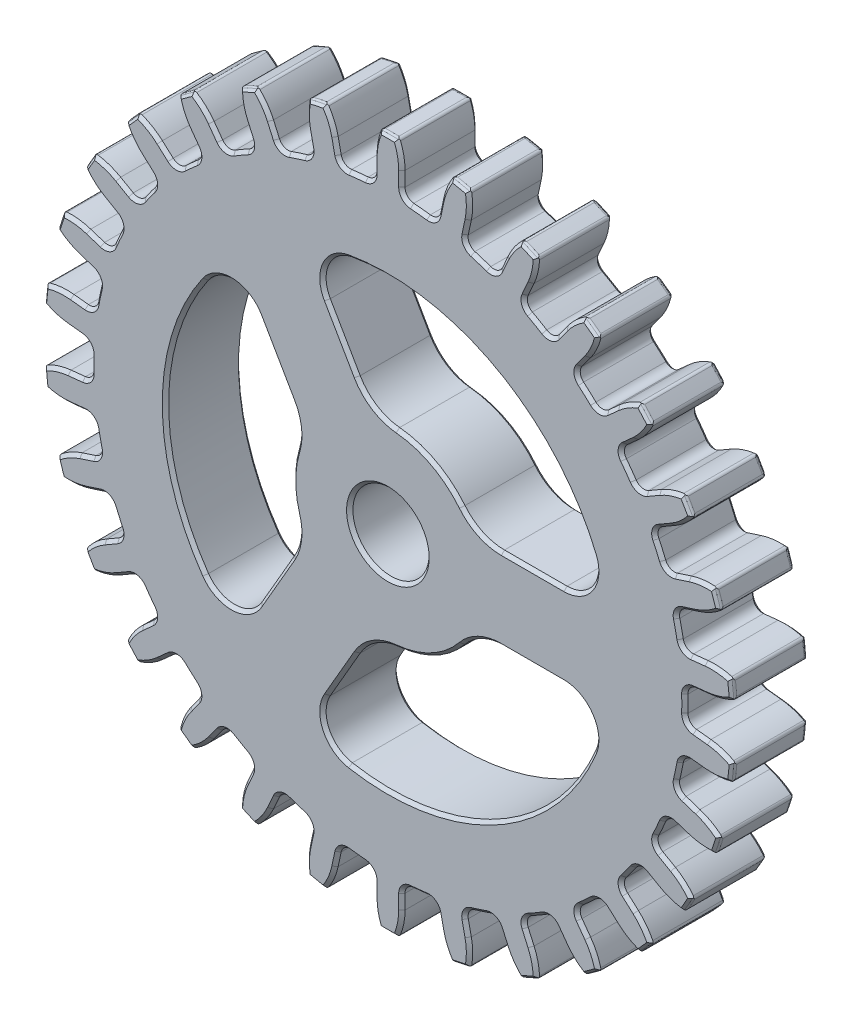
SolidWorks part; units mm, degrees
ref_plane "Спереди" through (0, 0, 0) normal (0, 0, 1) x (1, 0, 0)
ref_plane "Сверху" through (0, 0, 0) normal (0, 1, 0) x (1, 0, 0)
ref_plane "Справа" through (0, 0, 0) normal (1, 0, 0) x (0, 0, -1)
sketch "Эскиз1" plane through (0, 0, 0) normal (0, 0, 1) x (1, 0, 0)
  line L0 (0, 0) -> (27.2, 0) construction
  line L1 (0, 0) -> (0, 27.2) construction
  line L2 (8.9268, 3.25) -> (13.8542, 3.25)
  line L3 (8.9268, -3.25) -> (13.8542, -3.25)
  line L4 (-2.4255, -9.453) -> (-4.7744, -13.5213)
  line L5 (-7.5458, -5.3215) -> (-10.1442, -9.8222)
  line L6 (-7.5458, 5.3215) -> (-10.1442, 9.8222)
  line L7 (-2.4255, 9.453) -> (-4.7744, 13.5213)
  line L8 (0, 0) -> (-13.6, 23.5559) construction
  line L9 (-1.1, 25.2) -> (-1.1, 24.054)
  line L10 (1.1, 25.2) -> (1.1, 24.054)
  line L11 (4.1634, 24.878) -> (3.9251, 23.757)
  line L12 (6.3153, 24.4206) -> (6.0771, 23.2996)
  line L13 (9.2449, 23.4688) -> (8.7787, 22.4218)
  line L14 (11.2547, 22.5739) -> (10.7885, 21.527)
  line L15 (13.9223, 21.0338) -> (13.2486, 20.1066)
  line L16 (15.7021, 19.7407) -> (15.0285, 18.8135)
  line L17 (17.9912, 17.6796) -> (17.1395, 16.9127)
  line L18 (19.4633, 16.0446) -> (18.6116, 15.2778)
  line L19 (21.2738, 13.5526) -> (20.2813, 12.9796)
  line L20 (22.3738, 11.6474) -> (21.3813, 11.0744)
  line L21 (23.6267, 8.8334) -> (22.5368, 8.4792)
  line L22 (24.3065, 6.7411) -> (23.2166, 6.3869)
  line L23 (24.947, 3.7281) -> (23.8072, 3.6083)
  line L24 (25.1769, 1.5401) -> (24.0372, 1.4203)
  line L25 (25.1769, -1.5401) -> (24.0372, -1.4203)
  line L26 (24.947, -3.7281) -> (23.8072, -3.6083)
  line L27 (24.3065, -6.7411) -> (23.2166, -6.3869)
  line L28 (23.6267, -8.8334) -> (22.5368, -8.4792)
  line L29 (22.3738, -11.6474) -> (21.3813, -11.0744)
  line L30 (21.2738, -13.5526) -> (20.2813, -12.9796)
  line L31 (19.4633, -16.0446) -> (18.6116, -15.2778)
  line L32 (17.9912, -17.6796) -> (17.1395, -16.9127)
  line L33 (15.7021, -19.7407) -> (15.0285, -18.8135)
  line L34 (13.9223, -21.0338) -> (13.2486, -20.1066)
  line L35 (11.2547, -22.5739) -> (10.7885, -21.527)
  line L36 (9.2449, -23.4688) -> (8.7787, -22.4218)
  line L37 (6.3153, -24.4206) -> (6.0771, -23.2996)
  line L38 (4.1634, -24.878) -> (3.9251, -23.757)
  line L39 (1.1, -25.2) -> (1.1, -24.054)
  line L40 (-1.1, -25.2) -> (-1.1, -24.054)
  line L41 (-4.1634, -24.878) -> (-3.9251, -23.757)
  line L42 (-6.3153, -24.4206) -> (-6.0771, -23.2996)
  line L43 (-9.2449, -23.4688) -> (-8.7787, -22.4218)
  line L44 (-11.2547, -22.5739) -> (-10.7885, -21.527)
  line L45 (-13.9223, -21.0338) -> (-13.2486, -20.1066)
  line L46 (-15.7021, -19.7407) -> (-15.0285, -18.8135)
  line L47 (-17.9912, -17.6796) -> (-17.1395, -16.9127)
  line L48 (-19.4633, -16.0446) -> (-18.6116, -15.2778)
  line L49 (-21.2738, -13.5526) -> (-20.2813, -12.9796)
  line L50 (-22.3738, -11.6474) -> (-21.3813, -11.0744)
  line L51 (-23.6267, -8.8334) -> (-22.5368, -8.4792)
  line L52 (-24.3065, -6.7411) -> (-23.2166, -6.3869)
  line L53 (-24.947, -3.7281) -> (-23.8072, -3.6083)
  line L54 (-25.1769, -1.5401) -> (-24.0372, -1.4203)
  line L55 (-25.1769, 1.5401) -> (-24.0372, 1.4203)
  line L56 (-24.947, 3.7281) -> (-23.8072, 3.6083)
  line L57 (-24.3065, 6.7411) -> (-23.2166, 6.3869)
  line L58 (-23.6267, 8.8334) -> (-22.5368, 8.4792)
  line L59 (-22.3738, 11.6474) -> (-21.3813, 11.0744)
  line L60 (-21.2738, 13.5526) -> (-20.2813, 12.9796)
  line L61 (-19.4633, 16.0446) -> (-18.6116, 15.2778)
  line L62 (-17.9912, 17.6796) -> (-17.1395, 16.9127)
  line L63 (-15.7021, 19.7407) -> (-15.0285, 18.8135)
  line L64 (-13.9223, 21.0338) -> (-13.2486, 20.1066)
  line L65 (-11.2547, 22.5739) -> (-10.7885, 21.527)
  line L66 (-9.2449, 23.4688) -> (-8.7787, 22.4218)
  line L67 (-6.3153, 24.4206) -> (-6.0771, 23.2996)
  line L68 (-4.1634, 24.878) -> (-3.9251, 23.757)
  arc A0 (-13.6, 23.5559) -> (27.1141, -2.1597) centre (0, 0) ccw
  circle A1 centre (0, 0) radius 25.5 construction
  arc A2 (-1.7925, 23.3062) -> (-3.0923, 23.1696) centre (0, 0) ccw
  circle A3 centre (0, 0) radius 3
  arc A4 (5.8218, 4.7283) -> (0.6773, 7.4694) centre (0, 0) ccw
  arc A5 (16.1632, 6.7083) -> (-3.0442, 17.2332) centre (0, 0) ccw
  arc A6 (-14.3608, 10.0008) -> (-14.3608, -10.0008) centre (0, 0) ccw
  arc A7 (-3.0442, -17.2332) -> (16.1632, -6.7083) centre (0, 0) ccw
  arc A8 (0.6773, -7.4694) -> (5.8218, -4.7283) centre (0, 0) ccw
  arc A9 (-7.1804, 2.1662) -> (-7.1804, -2.1662) centre (0, 0) ccw
  arc A10 (-7.5458, 5.3215) -> (-7.1804, 2.1662) centre (-11.0099, 3.3215) cw
  arc A11 (-7.5458, -5.3215) -> (-7.1804, -2.1662) centre (-11.0099, -3.3215) ccw
  arc A12 (-2.4255, -9.453) -> (0.6773, -7.4694) centre (1.0386, -11.453) cw
  arc A13 (8.9268, -3.25) -> (5.8218, -4.7283) centre (8.9268, -7.25) ccw
  arc A14 (8.9268, 3.25) -> (5.8218, 4.7283) centre (8.9268, 7.25) cw
  arc A15 (-2.4255, 9.453) -> (0.6773, 7.4694) centre (1.0386, 11.453) ccw
  arc A16 (-10.1442, -9.8222) -> (-14.3608, -10.0008) centre (-12.3093, -8.5722) cw
  arc A17 (-4.7744, -13.5213) -> (-3.0442, -17.2332) centre (-2.6093, -14.7713) ccw
  arc A18 (13.8542, -3.25) -> (16.1632, -6.7083) centre (13.8542, -5.75) cw
  arc A19 (13.8542, 3.25) -> (16.1632, 6.7083) centre (13.8542, 5.75) ccw
  arc A20 (-4.7744, 13.5213) -> (-3.0442, 17.2332) centre (-2.6093, 14.7713) cw
  arc A21 (-10.1442, 9.8222) -> (-14.3608, 10.0008) centre (-12.3093, 8.5722) ccw
  arc A22 (-0.6863, 27.1913) -> (-1.1, 25.2) centre (3.9, 25.2) ccw
  arc A23 (0.6863, 27.1913) -> (1.1, 25.2) centre (-3.9, 25.2) cw
  arc A24 (0.6863, 27.1913) -> (-0.6863, 27.1913) centre (0, 0) ccw
  arc A25 (4.982, 26.7398) -> (4.1634, 24.878) centre (9.0542, 23.8385) ccw
  arc A26 (6.3247, 26.4544) -> (4.982, 26.7398) centre (0, 0) ccw
  arc A27 (6.3247, 26.4544) -> (6.3153, 24.4206) centre (1.4246, 25.4602) cw
  arc A28 (10.4327, 25.1197) -> (9.2449, 23.4688) centre (13.8126, 21.4351) ccw
  arc A29 (11.6867, 24.5614) -> (10.4327, 25.1197) centre (0, 0) ccw
  arc A30 (11.6867, 24.5614) -> (11.2547, 22.5739) centre (6.6869, 24.6076) cw
  arc A31 (15.4274, 22.4017) -> (13.9223, 21.0338) centre (17.9674, 18.0949) ccw
  arc A32 (16.5379, 21.5948) -> (15.4274, 22.4017) centre (0, 0) ccw
  arc A33 (16.5379, 21.5948) -> (15.7021, 19.7407) centre (11.657, 22.6796) cw
  arc A34 (19.7478, 18.7046) -> (17.9912, 17.6796) centre (21.3369, 13.9638) ccw
  arc A35 (20.6664, 17.6845) -> (19.7478, 18.7046) centre (0, 0) ccw
  arc A36 (20.6664, 17.6845) -> (19.4633, 16.0446) centre (16.1176, 19.7604) cw
  arc A37 (23.2052, 14.1901) -> (21.2738, 13.5526) centre (23.7738, 9.2225) ccw
  arc A38 (23.8916, 13.0013) -> (23.2052, 14.1901) centre (0, 0) ccw
  arc A39 (23.8916, 13.0013) -> (22.3738, 11.6474) centre (19.8738, 15.9775) cw
  arc A40 (25.6484, 9.0553) -> (23.6267, 8.8334) centre (25.1718, 4.0781) ccw
  arc A41 (26.0726, 7.7498) -> (25.6484, 9.0553) centre (0, 0) ccw
  arc A42 (26.0726, 7.7498) -> (24.3065, 6.7411) centre (22.7615, 11.4963) cw
  arc A43 (26.9706, 3.5249) -> (24.947, 3.7281) centre (25.4696, -1.2445) ccw
  arc A44 (27.1141, 2.1597) -> (26.9706, 3.5249) centre (0, 0) ccw
  arc A45 (27.1141, 2.1597) -> (25.1769, 1.5401) centre (24.6543, 6.5128) cw
  arc A46 (27.1141, -2.1597) -> (25.1769, -1.5401) centre (24.6543, -6.5128) ccw
  arc A47 (26.9706, -3.5249) -> (27.1141, -2.1597) centre (0, 0) ccw
  arc A48 (26.9706, -3.5249) -> (24.947, -3.7281) centre (25.4696, 1.2445) cw
  arc A49 (26.0726, -7.7498) -> (24.3065, -6.7411) centre (22.7615, -11.4963) ccw
  arc A50 (25.6484, -9.0553) -> (26.0726, -7.7498) centre (0, 0) ccw
  arc A51 (25.6484, -9.0553) -> (23.6267, -8.8334) centre (25.1718, -4.0781) cw
  arc A52 (23.8916, -13.0013) -> (22.3738, -11.6474) centre (19.8738, -15.9775) ccw
  arc A53 (23.2052, -14.1901) -> (23.8916, -13.0013) centre (0, 0) ccw
  arc A54 (23.2052, -14.1901) -> (21.2738, -13.5526) centre (23.7738, -9.2225) cw
  arc A55 (20.6664, -17.6845) -> (19.4633, -16.0446) centre (16.1176, -19.7604) ccw
  arc A56 (19.7478, -18.7046) -> (20.6664, -17.6845) centre (0, 0) ccw
  arc A57 (19.7478, -18.7046) -> (17.9912, -17.6796) centre (21.3369, -13.9638) cw
  arc A58 (16.5379, -21.5948) -> (15.7021, -19.7407) centre (11.657, -22.6796) ccw
  arc A59 (15.4274, -22.4017) -> (16.5379, -21.5948) centre (0, 0) ccw
  arc A60 (15.4274, -22.4017) -> (13.9223, -21.0338) centre (17.9674, -18.0949) cw
  arc A61 (11.6867, -24.5614) -> (11.2547, -22.5739) centre (6.6869, -24.6076) ccw
  arc A62 (10.4327, -25.1197) -> (11.6867, -24.5614) centre (0, 0) ccw
  arc A63 (10.4327, -25.1197) -> (9.2449, -23.4688) centre (13.8126, -21.4351) cw
  arc A64 (6.3247, -26.4544) -> (6.3153, -24.4206) centre (1.4246, -25.4602) ccw
  arc A65 (4.982, -26.7398) -> (6.3247, -26.4544) centre (0, 0) ccw
  arc A66 (4.982, -26.7398) -> (4.1634, -24.878) centre (9.0542, -23.8385) cw
  arc A67 (0.6863, -27.1913) -> (1.1, -25.2) centre (-3.9, -25.2) ccw
  arc A68 (-0.6863, -27.1913) -> (0.6863, -27.1913) centre (0, 0) ccw
  arc A69 (-0.6863, -27.1913) -> (-1.1, -25.2) centre (3.9, -25.2) cw
  arc A70 (-4.982, -26.7398) -> (-4.1634, -24.878) centre (-9.0542, -23.8385) ccw
  arc A71 (-6.3247, -26.4544) -> (-4.982, -26.7398) centre (0, 0) ccw
  arc A72 (-6.3247, -26.4544) -> (-6.3153, -24.4206) centre (-1.4246, -25.4602) cw
  arc A73 (-10.4327, -25.1197) -> (-9.2449, -23.4688) centre (-13.8126, -21.4351) ccw
  arc A74 (-11.6867, -24.5614) -> (-10.4327, -25.1197) centre (0, 0) ccw
  arc A75 (-11.6867, -24.5614) -> (-11.2547, -22.5739) centre (-6.6869, -24.6076) cw
  arc A76 (-15.4274, -22.4017) -> (-13.9223, -21.0338) centre (-17.9674, -18.0949) ccw
  arc A77 (-16.5379, -21.5948) -> (-15.4274, -22.4017) centre (0, 0) ccw
  arc A78 (-16.5379, -21.5948) -> (-15.7021, -19.7407) centre (-11.657, -22.6796) cw
  arc A79 (-19.7478, -18.7046) -> (-17.9912, -17.6796) centre (-21.3369, -13.9638) ccw
  arc A80 (-20.6664, -17.6845) -> (-19.7478, -18.7046) centre (0, 0) ccw
  arc A81 (-20.6664, -17.6845) -> (-19.4633, -16.0446) centre (-16.1176, -19.7604) cw
  arc A82 (-23.2052, -14.1901) -> (-21.2738, -13.5526) centre (-23.7738, -9.2225) ccw
  arc A83 (-23.8916, -13.0013) -> (-23.2052, -14.1901) centre (0, 0) ccw
  arc A84 (-23.8916, -13.0013) -> (-22.3738, -11.6474) centre (-19.8738, -15.9775) cw
  arc A85 (-25.6484, -9.0553) -> (-23.6267, -8.8334) centre (-25.1718, -4.0781) ccw
  arc A86 (-26.0726, -7.7498) -> (-25.6484, -9.0553) centre (0, 0) ccw
  arc A87 (-26.0726, -7.7498) -> (-24.3065, -6.7411) centre (-22.7615, -11.4963) cw
  arc A88 (-26.9706, -3.5249) -> (-24.947, -3.7281) centre (-25.4696, 1.2445) ccw
  arc A89 (-27.1141, -2.1597) -> (-26.9706, -3.5249) centre (0, 0) ccw
  arc A90 (-27.1141, -2.1597) -> (-25.1769, -1.5401) centre (-24.6543, -6.5128) cw
  arc A91 (-27.1141, 2.1597) -> (-25.1769, 1.5401) centre (-24.6543, 6.5128) ccw
  arc A92 (-26.9706, 3.5249) -> (-27.1141, 2.1597) centre (0, 0) ccw
  arc A93 (-26.9706, 3.5249) -> (-24.947, 3.7281) centre (-25.4696, -1.2445) cw
  arc A94 (-26.0726, 7.7498) -> (-24.3065, 6.7411) centre (-22.7615, 11.4963) ccw
  arc A95 (-25.6484, 9.0553) -> (-26.0726, 7.7498) centre (0, 0) ccw
  arc A96 (-25.6484, 9.0553) -> (-23.6267, 8.8334) centre (-25.1718, 4.0781) cw
  arc A97 (-23.8916, 13.0013) -> (-22.3738, 11.6474) centre (-19.8738, 15.9775) ccw
  arc A98 (-23.2052, 14.1901) -> (-23.8916, 13.0013) centre (0, 0) ccw
  arc A99 (-23.2052, 14.1901) -> (-21.2738, 13.5526) centre (-23.7738, 9.2225) cw
  arc A100 (-20.6664, 17.6845) -> (-19.4633, 16.0446) centre (-16.1176, 19.7604) ccw
  arc A101 (-19.7478, 18.7046) -> (-20.6664, 17.6845) centre (0, 0) ccw
  arc A102 (-19.7478, 18.7046) -> (-17.9912, 17.6796) centre (-21.3369, 13.9638) cw
  arc A103 (-16.5379, 21.5948) -> (-15.7021, 19.7407) centre (-11.657, 22.6796) ccw
  arc A104 (-15.4274, 22.4017) -> (-16.5379, 21.5948) centre (0, 0) ccw
  arc A105 (-15.4274, 22.4017) -> (-13.9223, 21.0338) centre (-17.9674, 18.0949) cw
  arc A106 (-11.6867, 24.5614) -> (-11.2547, 22.5739) centre (-6.6869, 24.6076) ccw
  arc A107 (-10.4327, 25.1197) -> (-11.6867, 24.5614) centre (0, 0) ccw
  arc A108 (-10.4327, 25.1197) -> (-9.2449, 23.4688) centre (-13.8126, 21.4351) cw
  arc A109 (-6.3247, 26.4544) -> (-6.3153, 24.4206) centre (-1.4246, 25.4602) ccw
  arc A110 (-4.982, 26.7398) -> (-6.3247, 26.4544) centre (0, 0) ccw
  arc A111 (-4.982, 26.7398) -> (-4.1634, 24.878) centre (-9.0542, 23.8385) cw
  arc A112 (3.0923, 23.1696) -> (1.7925, 23.3062) centre (0, 0) ccw
  arc A113 (-6.5989, 22.4242) -> (-7.842, 22.0203) centre (0, 0) ccw
  arc A114 (-11.117, 20.5622) -> (-12.2489, 19.9087) centre (0, 0) ccw
  arc A115 (7.842, 22.0203) -> (6.5989, 22.4242) centre (0, 0) ccw
  arc A116 (12.2489, 19.9087) -> (11.117, 20.5622) centre (0, 0) ccw
  arc A117 (16.1205, 16.9269) -> (15.1492, 17.8015) centre (0, 0) ccw
  arc A118 (19.2875, 13.2054) -> (18.5193, 14.2628) centre (0, 0) ccw
  arc A119 (21.6116, 8.9068) -> (21.08, 10.1007) centre (0, 0) ccw
  arc A120 (22.9911, 4.2188) -> (22.7194, 5.4972) centre (0, 0) ccw
  arc A121 (23.3659, -0.6535) -> (23.3659, 0.6535) centre (0, 0) ccw
  arc A122 (22.7194, -5.4972) -> (22.9911, -4.2188) centre (0, 0) ccw
  arc A123 (21.08, -10.1007) -> (21.6116, -8.9068) centre (0, 0) ccw
  arc A124 (18.5193, -14.2628) -> (19.2875, -13.2054) centre (0, 0) ccw
  arc A125 (15.1492, -17.8015) -> (16.1205, -16.9269) centre (0, 0) ccw
  arc A126 (11.117, -20.5622) -> (12.2489, -19.9087) centre (0, 0) ccw
  arc A127 (6.5989, -22.4242) -> (7.842, -22.0203) centre (0, 0) ccw
  arc A128 (1.7925, -23.3062) -> (3.0923, -23.1696) centre (0, 0) ccw
  arc A129 (-3.0923, -23.1696) -> (-1.7925, -23.3062) centre (0, 0) ccw
  arc A130 (-7.842, -22.0203) -> (-6.5989, -22.4242) centre (0, 0) ccw
  arc A131 (-12.2489, -19.9087) -> (-11.117, -20.5622) centre (0, 0) ccw
  arc A132 (-16.1205, -16.9269) -> (-15.1492, -17.8015) centre (0, 0) ccw
  arc A133 (-19.2875, -13.2054) -> (-18.5193, -14.2628) centre (0, 0) ccw
  arc A134 (-21.6116, -8.9068) -> (-21.08, -10.1007) centre (0, 0) ccw
  arc A135 (-22.9911, -4.2188) -> (-22.7194, -5.4972) centre (0, 0) ccw
  arc A136 (-23.3659, 0.6535) -> (-23.3659, -0.6535) centre (0, 0) ccw
  arc A137 (-22.7194, 5.4972) -> (-22.9911, 4.2188) centre (0, 0) ccw
  arc A138 (-21.08, 10.1007) -> (-21.6116, 8.9068) centre (0, 0) ccw
  arc A139 (-18.5193, 14.2628) -> (-19.2875, 13.2054) centre (0, 0) ccw
  arc A140 (-15.1492, 17.8015) -> (-16.1205, 16.9269) centre (0, 0) ccw
  arc A141 (23.8072, 3.6083) -> (22.9911, 4.2188) centre (23.7288, 4.3542) cw
  arc A142 (23.2166, 6.3869) -> (22.7194, 5.4972) centre (23.4484, 5.6736) ccw
  arc A143 (24.0372, 1.4203) -> (23.3659, 0.6535) centre (24.1156, 0.6745) ccw
  arc A144 (24.0372, -1.4203) -> (23.3659, -0.6535) centre (24.1156, -0.6745) cw
  arc A145 (23.2166, -6.3869) -> (22.7194, -5.4972) centre (23.4484, -5.6736) cw
  arc A146 (23.8072, -3.6083) -> (22.9911, -4.2188) centre (23.7288, -4.3542) ccw
  arc A147 (22.5368, -8.4792) -> (21.6116, -8.9068) centre (22.305, -9.1925) ccw
  arc A148 (21.3813, -11.0744) -> (21.08, -10.1007) centre (21.7563, -10.4248) cw
  arc A149 (20.2813, -12.9796) -> (19.2875, -13.2054) centre (19.9063, -13.6291) ccw
  arc A150 (18.6116, -15.2778) -> (18.5193, -14.2628) centre (19.1135, -14.7204) cw
  arc A151 (15.0285, -18.8135) -> (15.1492, -17.8015) centre (15.6352, -18.3727) cw
  arc A152 (17.1395, -16.9127) -> (16.1205, -16.9269) centre (16.6377, -17.4701) ccw
  arc A153 (13.2486, -20.1066) -> (12.2489, -19.9087) centre (12.6419, -20.5475) ccw
  arc A154 (10.7885, -21.527) -> (11.117, -20.5622) centre (11.4737, -21.2219) cw
  arc A155 (8.7787, -22.4218) -> (7.842, -22.0203) centre (8.0936, -22.7269) ccw
  arc A156 (6.0771, -23.2996) -> (6.5989, -22.4242) centre (6.8107, -23.1437) cw
  arc A157 (3.9251, -23.757) -> (3.0923, -23.1696) centre (3.1915, -23.913) ccw
  arc A158 (1.1, -24.054) -> (1.7925, -23.3062) centre (1.85, -24.054) cw
  arc A159 (-1.1, -24.054) -> (-1.7925, -23.3062) centre (-1.85, -24.054) ccw
  arc A160 (-3.9251, -23.757) -> (-3.0923, -23.1696) centre (-3.1915, -23.913) cw
  arc A161 (-6.0771, -23.2996) -> (-6.5989, -22.4242) centre (-6.8107, -23.1437) ccw
  arc A162 (-8.7787, -22.4218) -> (-7.842, -22.0203) centre (-8.0936, -22.7269) cw
  arc A163 (-10.7885, -21.527) -> (-11.117, -20.5622) centre (-11.4737, -21.2219) ccw
  arc A164 (-13.2486, -20.1066) -> (-12.2489, -19.9087) centre (-12.6419, -20.5475) cw
  arc A165 (-15.0285, -18.8135) -> (-15.1492, -17.8015) centre (-15.6352, -18.3727) ccw
  arc A166 (-17.1395, -16.9127) -> (-16.1205, -16.9269) centre (-16.6377, -17.4701) cw
  arc A167 (-18.6116, -15.2778) -> (-18.5193, -14.2628) centre (-19.1135, -14.7204) ccw
  arc A168 (-20.2813, -12.9796) -> (-19.2875, -13.2054) centre (-19.9063, -13.6291) cw
  arc A169 (-21.3813, -11.0744) -> (-21.08, -10.1007) centre (-21.7563, -10.4248) ccw
  arc A170 (-22.5368, -8.4792) -> (-21.6116, -8.9068) centre (-22.305, -9.1925) cw
  arc A171 (-23.2166, -6.3869) -> (-22.7194, -5.4972) centre (-23.4484, -5.6736) ccw
  arc A172 (-23.8072, -3.6083) -> (-22.9911, -4.2188) centre (-23.7288, -4.3542) cw
  arc A173 (-24.0372, -1.4203) -> (-23.3659, -0.6535) centre (-24.1156, -0.6745) ccw
  arc A174 (-24.0372, 1.4203) -> (-23.3659, 0.6535) centre (-24.1156, 0.6745) cw
  arc A175 (-23.8072, 3.6083) -> (-22.9911, 4.2188) centre (-23.7288, 4.3542) ccw
  arc A176 (-23.2166, 6.3869) -> (-22.7194, 5.4972) centre (-23.4484, 5.6736) cw
  arc A177 (-22.5368, 8.4792) -> (-21.6116, 8.9068) centre (-22.305, 9.1925) ccw
  arc A178 (-21.3813, 11.0744) -> (-21.08, 10.1007) centre (-21.7563, 10.4248) cw
  arc A179 (-20.2813, 12.9796) -> (-19.2875, 13.2054) centre (-19.9063, 13.6291) ccw
  arc A180 (-10.7885, 21.527) -> (-11.117, 20.5622) centre (-11.4737, 21.2219) cw
  arc A181 (-18.6116, 15.2778) -> (-18.5193, 14.2628) centre (-19.1135, 14.7204) cw
  arc A182 (-17.1395, 16.9127) -> (-16.1205, 16.9269) centre (-16.6377, 17.4701) ccw
  arc A183 (-15.0285, 18.8135) -> (-15.1492, 17.8015) centre (-15.6352, 18.3727) cw
  arc A184 (-13.2486, 20.1066) -> (-12.2489, 19.9087) centre (-12.6419, 20.5475) ccw
  arc A185 (22.5368, 8.4792) -> (21.6116, 8.9068) centre (22.305, 9.1925) cw
  arc A186 (21.3813, 11.0744) -> (21.08, 10.1007) centre (21.7563, 10.4248) ccw
  arc A187 (20.2813, 12.9796) -> (19.2875, 13.2054) centre (19.9063, 13.6291) cw
  arc A188 (18.6116, 15.2778) -> (18.5193, 14.2628) centre (19.1135, 14.7204) ccw
  arc A189 (17.1395, 16.9127) -> (16.1205, 16.9269) centre (16.6377, 17.4701) cw
  arc A190 (15.0285, 18.8135) -> (15.1492, 17.8015) centre (15.6352, 18.3727) ccw
  arc A191 (13.2486, 20.1066) -> (12.2489, 19.9087) centre (12.6419, 20.5475) cw
  arc A192 (10.7885, 21.527) -> (11.117, 20.5622) centre (11.4737, 21.2219) ccw
  arc A193 (8.7787, 22.4218) -> (7.842, 22.0203) centre (8.0936, 22.7269) cw
  arc A194 (6.0771, 23.2996) -> (6.5989, 22.4242) centre (6.8107, 23.1437) ccw
  arc A195 (3.9251, 23.757) -> (3.0923, 23.1696) centre (3.1915, 23.913) cw
  arc A196 (1.1, 24.054) -> (1.7925, 23.3062) centre (1.85, 24.054) ccw
  arc A197 (-1.1, 24.054) -> (-1.7925, 23.3062) centre (-1.85, 24.054) cw
  arc A198 (-3.9251, 23.757) -> (-3.0923, 23.1696) centre (-3.1915, 23.913) ccw
  arc A199 (-6.0771, 23.2996) -> (-6.5989, 22.4242) centre (-6.8107, 23.1437) cw
  arc A200 (-8.7787, 22.4218) -> (-7.842, 22.0203) centre (-8.0936, 22.7269) ccw
  point P14 (-6.566, 3.6246)
  point P29 (6.7593, -3.25)
  point P32 (6.7593, 3.25)
  point P41 (17.1956, -3.25)
  point P44 (17.1956, 3.25)
  point P429 (1.1, 23.3491)
  point P432 (-1.1, 23.3491)
  dimension "D1" = 54.4
  dimension "D2" = 51
  dimension "D3" = 46.75
  dimension "D4" = 6
  dimension "D5" = 15
  dimension "D6" = 35
  dimension "D9" = 4
  dimension "D10" = 2.5
  dimension "D12" = 10
  dimension "D15" = 0.75
  dimension "D7" = 6.5
  dimension "D11" = 120
  dimension "D13" = 2.2
  dimension "D14" = 30
  dimension "D8" = 3
extrude "Бобышка-Вытянуть1" add sketch "Эскиз1" along normal blind 6 contours A200 L66 A108 A107 A106 L65 A180 A114 A184 L64 A105 A0 A103 L63 A183 A140 A182 L62 A102 A100 L61 A181 A139 A179 L60 A99 A97 L59 A178 A138 A177 L58 A96 A94 L57 A176 A137 A175 L56 A93 A91 L55 A174 A136 A173 L54 A90
chamfer "Фаска1" distance 0.25 angle 45 400 edges at (-8.845, 7.5718, 0) (-7.0364, 3.7817, 0) (-7.5, 0, 0) (-7.0364, -3.7817, 0) (-8.845, -7.5718, 0) (-12.2034, -11.0699, 0) (-17.5, 0, 0) (-12.2034, 11.0699, 0) (15.9333, -4.3618, 0) (8.4095, -15.347, 0) (-4.8752, -15.8275, 0) (-3.5999, -11.4872, 0) (-1.116, -8.0828, 0) (3.5268, -6.6191, 0) (7.2073, -3.6384, 0) (11.3905, -3.25, 0) (3, 0, 0) (-4.8752, 15.8275, 0) (8.4095, 15.347, 0) (15.9333, 4.3618, 0) (11.3905, 3.25, 0) (7.2073, 3.6384, 0) (3.5268, 6.6191, 0) (-1.116, 8.0828, 0) (-3.5999, 11.4872, 0) (-9.0118, 22.9453, 0) (-9.754, 24.3553, 0) (-11.0632, 24.8484, 0) (-11.5728, 23.5454, 0) (-11.0216, 22.0505, 0) (-10.7637, 20.9802, 0) (-11.6875, 20.2433, 0) (-12.7875, 19.8117, 0) (-13.5855, 20.5702, 0) (-14.6045, 21.7951, 0) (-15.9878, 22.0053, 0) (-16.2153, 20.6248, 0) (-15.3653, 19.2771, 0) (-14.8905, 18.2838, 0) (-15.6409, 17.371, 0) (-16.6272, 16.7201, 0) (-17.5654, 17.2961, 0) (-18.8169, 18.2823, 0) (-20.2135, 18.2004, 0) (-20.1491, 16.8028, 0) (-19.0375, 15.6612, 0) (-18.3666, 14.7884, 0) (-18.9108, 13.7395, 0) (-19.7402, 12.8978, 0) (-20.7776, 13.2661, 0) (-22.2068, 13.9706, 0) (-23.5559, 13.6, 0) (-23.2023, 12.2463, 0) (-21.8776, 11.3609, 0) (-21.0399, 10.6466, 0) (-21.3541, 9.5075, 0) (-21.9904, 8.5117, 0) (-23.0817, 8.6563, 0) (-24.6262, 9.0482, 0) (-25.8687, 8.4053, 0) (-25.2414, 7.1547, 0) (-23.7616, 6.564, 0) (-22.7937, 6.0395, 0) (-22.8642, 4.8599, 0) (-23.2795, 3.7536, 0) (-24.3771, 3.6682, 0) (-25.9692, 3.7305, 0) (-27.051, 2.8432, 0) (-26.1774, 1.7504, 0) (-24.6071, 1.4802, 0) (-23.5513, 1.1685, 0) (-23.375, 0, 0) (-23.5513, -1.1685, 0) (-24.6071, -1.4802, 0) (-26.1774, -1.7504, 0) (-27.051, -2.8432, 0) (-25.9692, -3.7305, 0) (-24.3771, -3.6682, 0) (-23.2795, -3.7536, 0) (-22.8642, -4.8599, 0) (-22.7937, -6.0395, 0) (-23.7616, -6.564, 0) (-25.2414, -7.1547, 0) (-25.8687, -8.4053, 0) (-24.6262, -9.0482, 0) (-23.0817, -8.6563, 0) (-21.9904, -8.5117, 0) (-21.3541, -9.5075, 0) (-21.0399, -10.6466, 0) (-21.8776, -11.3609, 0) (-23.2023, -12.2463, 0) (-23.5559, -13.6, 0) (-22.2068, -13.9706, 0) (-20.7776, -13.2661, 0) (-19.7402, -12.8978, 0) (-18.9108, -13.7395, 0) (-18.3666, -14.7884, 0) (-19.0375, -15.6612, 0) (-20.1491, -16.8028, 0) (-20.2135, -18.2004, 0) (-18.8169, -18.2823, 0) (-17.5654, -17.2961, 0) (-16.6272, -16.7201, 0) (-15.6409, -17.371, 0) (-14.8905, -18.2838, 0) (-15.3653, -19.2771, 0) (-16.2153, -20.6248, 0) (-15.9878, -22.0053, 0) (-14.6045, -21.7951, 0) (-13.5855, -20.5702, 0) (-12.7875, -19.8117, 0) (-11.6875, -20.2433, 0) (-10.7637, -20.9802, 0) (-11.0216, -22.0505, 0) (-11.5728, -23.5454, 0) (-11.0632, -24.8484, 0) (-9.754, -24.3553, 0) (-9.0118, -22.9453, 0) (-8.389, -22.0375, 0) (-7.2233, -22.2309, 0) (-6.1665, -22.7596, 0) (-6.1962, -23.8601, 0) (-6.4245, -25.437, 0) (-5.6552, -26.6056, 0) (-4.4771, -25.851, 0) (-4.0443, -24.3175, 0) (-3.6238, -23.3001, 0) (-2.4434, -23.2469, 0) (-1.2997, -23.5444, 0) (-1.1, -24.627, 0) (-0.9955, -26.2169, 0) (0, -27.2, 0) (0.9955, -26.2169, 0) (1.1, -24.627, 0) (1.2997, -23.5444, 0) (2.4434, -23.2469, 0) (3.6238, -23.3001, 0) (4.0443, -24.3175, 0) (4.4771, -25.851, 0) (5.6552, -26.6056, 0) (6.4245, -25.437, 0) (6.1962, -23.8601, 0) (6.1665, -22.7596, 0) (7.2233, -22.2309, 0) (8.389, -22.0375, 0) (9.0118, -22.9453, 0) (9.754, -24.3553, 0) (11.0632, -24.8484, 0) (11.5728, -23.5454, 0) (11.0216, -22.0505, 0) (10.7637, -20.9802, 0) (11.6875, -20.2433, 0) (12.7875, -19.8117, 0) (13.5855, -20.5702, 0) (14.6045, -21.7951, 0) (15.9878, -22.0053, 0) (16.2153, -20.6248, 0) (15.3653, -19.2771, 0) (14.8905, -18.2838, 0) (15.6409, -17.371, 0) (16.6272, -16.7201, 0) (17.5654, -17.2961, 0) (18.8169, -18.2823, 0) (20.2135, -18.2004, 0) (20.1491, -16.8028, 0) (19.0375, -15.6612, 0) (18.3666, -14.7884, 0) (18.9108, -13.7395, 0) (19.7402, -12.8978, 0) (20.7776, -13.2661, 0) (22.2068, -13.9706, 0) (23.5559, -13.6, 0) (23.2023, -12.2463, 0) (21.8776, -11.3609, 0) (21.0399, -10.6466, 0) (21.3541, -9.5075, 0) (21.9904, -8.5117, 0) (23.0817, -8.6563, 0) (24.6262, -9.0482, 0) (25.8687, -8.4053, 0) (25.2414, -7.1547, 0) (23.7616, -6.564, 0) (22.7937, -6.0395, 0) (22.8642, -4.8599, 0) (23.2795, -3.7536, 0) (24.3771, -3.6682, 0) (25.9692, -3.7305, 0) (27.051, -2.8432, 0) (26.1774, -1.7504, 0) (24.6071, -1.4802, 0) (23.5513, -1.1685, 0) (23.375, 0, 0) (23.5513, 1.1685, 0) (24.6071, 1.4802, 0) (26.1774, 1.7504, 0) (27.051, 2.8432, 0) (25.9692, 3.7305, 0) (24.3771, 3.6682, 0) (23.2795, 3.7536, 0) (22.8642, 4.8599, 0) (22.7937, 6.0395, 0) (23.7616, 6.564, 0) (25.2414, 7.1547, 0) (25.8687, 8.4053, 0) (24.6262, 9.0482, 0) (23.0817, 8.6563, 0) (21.9904, 8.5117, 0) (21.3541, 9.5075, 0) (21.0399, 10.6466, 0) (21.8776, 11.3609, 0) (23.2023, 12.2463, 0) (23.5559, 13.6, 0) (22.2068, 13.9706, 0) (20.7776, 13.2661, 0) (19.7402, 12.8978, 0) (18.9108, 13.7395, 0) (18.3666, 14.7884, 0) (19.0375, 15.6612, 0) (20.1491, 16.8028, 0) (20.2135, 18.2004, 0) (18.8169, 18.2823, 0) (17.5654, 17.2961, 0) (16.6272, 16.7201, 0) (15.6409, 17.371, 0) (14.8905, 18.2838, 0) (15.3653, 19.2771, 0) (16.2153, 20.6248, 0) (15.9878, 22.0053, 0) (14.6045, 21.7951, 0) (13.5855, 20.5702, 0) (12.7875, 19.8117, 0) (11.6875, 20.2433, 0) (10.7637, 20.9802, 0) (11.0216, 22.0505, 0) (11.5728, 23.5454, 0) (11.0632, 24.8484, 0) (9.754, 24.3553, 0) (9.0118, 22.9453, 0) (8.389, 22.0375, 0) (7.2233, 22.2309, 0) (6.1665, 22.7596, 0) (6.1962, 23.8601, 0) (6.4245, 25.437, 0) (5.6552, 26.6056, 0) (4.4771, 25.851, 0) (4.0443, 24.3175, 0) (3.6238, 23.3001, 0) (2.4434, 23.2469, 0) (1.2997, 23.5444, 0) (1.1, 24.627, 0) (0.9955, 26.2169, 0) (0, 27.2, 0) (-0.9955, 26.2169, 0) (-1.1, 24.627, 0) (-1.2997, 23.5444, 0) (-2.4434, 23.2469, 0) (-3.6238, 23.3001, 0) (-4.0443, 24.3175, 0) (-4.4771, 25.851, 0) (-5.6552, 26.6056, 0) (-6.4245, 25.437, 0) (-6.1962, 23.8601, 0) (-6.1665, 22.7596, 0) (-7.2233, 22.2309, 0) (-8.389, 22.0375, 0) (-17.5, 0, 6) (-12.2034, -11.0699, 6) (-8.845, -7.5718, 6) (-7.0364, -3.7817, 6) (-7.5, 0, 6) (-7.0364, 3.7817, 6) (-8.845, 7.5718, 6) (-12.2034, 11.0699, 6) (7.2073, -3.6384, 6) (3.5268, -6.6191, 6) (-1.116, -8.0828, 6) (-3.5999, -11.4872, 6) (-4.8752, -15.8275, 6) (8.4095, -15.347, 6) (15.9333, -4.3618, 6) (11.3905, -3.25, 6) (3, 0, 6) (-1.116, 8.0828, 6) (3.5268, 6.6191, 6) (7.2073, 3.6384, 6) (11.3905, 3.25, 6) (15.9333, 4.3618, 6) (8.4095, 15.347, 6) (-4.8752, 15.8275, 6) (-3.5999, 11.4872, 6) (-7.2233, 22.2309, 6) (-6.1665, 22.7596, 6) (-6.1962, 23.8601, 6) (-6.4245, 25.437, 6) (-5.6552, 26.6056, 6) (-4.4771, 25.851, 6) (-4.0443, 24.3175, 6) (-3.6238, 23.3001, 6) (-2.4434, 23.2469, 6) (-1.2997, 23.5444, 6) (-1.1, 24.627, 6) (-0.9955, 26.2169, 6) (0, 27.2, 6) (0.9955, 26.2169, 6) (1.1, 24.627, 6) (1.2997, 23.5444, 6) (2.4434, 23.2469, 6) (3.6238, 23.3001, 6) (4.0443, 24.3175, 6) (4.4771, 25.851, 6) (5.6552, 26.6056, 6) (6.4245, 25.437, 6) (6.1962, 23.8601, 6) (6.1665, 22.7596, 6) (7.2233, 22.2309, 6) (8.389, 22.0375, 6) (9.0118, 22.9453, 6) (9.754, 24.3553, 6) (11.0632, 24.8484, 6) (11.5728, 23.5454, 6) (11.0216, 22.0505, 6) (10.7637, 20.9802, 6) (11.6875, 20.2433, 6) (12.7875, 19.8117, 6) (13.5855, 20.5702, 6) (14.6045, 21.7951, 6) (15.9878, 22.0053, 6) (16.2153, 20.6248, 6) (15.3653, 19.2771, 6) (14.8905, 18.2838, 6) (15.6409, 17.371, 6) (16.6272, 16.7201, 6) (17.5654, 17.2961, 6) (18.8169, 18.2823, 6) (20.2135, 18.2004, 6) (20.1491, 16.8028, 6) (19.0375, 15.6612, 6) (18.3666, 14.7884, 6) (18.9108, 13.7395, 6) (19.7402, 12.8978, 6) (20.7776, 13.2661, 6) (22.2068, 13.9706, 6) (23.5559, 13.6, 6) (23.2023, 12.2463, 6) (21.8776, 11.3609, 6) (21.0399, 10.6466, 6) (21.3541, 9.5075, 6) (21.9904, 8.5117, 6) (23.0817, 8.6563, 6) (24.6262, 9.0482, 6) (25.8687, 8.4053, 6) (25.2414, 7.1547, 6) (23.7616, 6.564, 6) (22.7937, 6.0395, 6) (22.8642, 4.8599, 6) (23.2795, 3.7536, 6) (24.3771, 3.6682, 6) (25.9692, 3.7305, 6) (27.051, 2.8432, 6) (26.1774, 1.7504, 6) (24.6071, 1.4802, 6) (23.5513, 1.1685, 6) (23.375, 0, 6) (23.5513, -1.1685, 6) (24.6071, -1.4802, 6) (26.1774, -1.7504, 6) (27.051, -2.8432, 6) (25.9692, -3.7305, 6) (24.3771, -3.6682, 6) (23.2795, -3.7536, 6) (22.8642, -4.8599, 6) (22.7937, -6.0395, 6) (23.7616, -6.564, 6) (25.2414, -7.1547, 6) (25.8687, -8.4053, 6) (24.6262, -9.0482, 6) (23.0817, -8.6563, 6) (21.9904, -8.5117, 6) (21.3541, -9.5075, 6) (21.0399, -10.6466, 6) (21.8776, -11.3609, 6) (23.2023, -12.2463, 6) (23.5559, -13.6, 6) (22.2068, -13.9706, 6) (20.7776, -13.2661, 6) (19.7402, -12.8978, 6) (18.9108, -13.7395, 6) (18.3666, -14.7884, 6) (19.0375, -15.6612, 6) (20.1491, -16.8028, 6) (20.2135, -18.2004, 6) (18.8169, -18.2823, 6) (17.5654, -17.2961, 6) (16.6272, -16.7201, 6) (15.6409, -17.371, 6) (14.8905, -18.2838, 6) (15.3653, -19.2771, 6) (16.2153, -20.6248, 6) (15.9878, -22.0053, 6) (14.6045, -21.7951, 6)
fillet "Скругление1" radius 0.25 120 edges at (-11.0632, 24.8484, 5.75) (-11.6867, 24.5614, 3) (-11.0632, 24.8484, 0.25) (-10.4327, 25.1197, 3) (-15.9878, 22.0053, 5.75) (-16.5379, 21.5948, 3) (-15.9878, 22.0053, 0.25) (-15.4274, 22.4017, 3) (-20.2135, 18.2004, 5.75) (-20.6664, 17.6845, 3) (-20.2135, 18.2004, 0.25) (-19.7478, 18.7046, 3) (-23.5559, 13.6, 5.75) (-23.8916, 13.0013, 3) (-23.5559, 13.6, 0.25) (-23.2052, 14.1901, 3) (-25.8687, 8.4053, 5.75) (-26.0726, 7.7498, 3) (-25.8687, 8.4053, 0.25) (-25.6484, 9.0553, 3) (-27.051, 2.8432, 5.75) (-27.1141, 2.1597, 3) (-27.051, 2.8432, 0.25) (-26.9706, 3.5249, 3) (-27.051, -2.8432, 5.75) (-26.9706, -3.5249, 3) (-27.051, -2.8432, 0.25) (-27.1141, -2.1597, 3) (-25.8687, -8.4053, 5.75) (-25.6484, -9.0553, 3) (-25.8687, -8.4053, 0.25) (-26.0726, -7.7498, 3) (-23.5559, -13.6, 5.75) (-23.2052, -14.1901, 3) (-23.5559, -13.6, 0.25) (-23.8916, -13.0013, 3) (-20.2135, -18.2004, 5.75) (-19.7478, -18.7046, 3) (-20.2135, -18.2004, 0.25) (-20.6664, -17.6845, 3) (-15.9878, -22.0053, 5.75) (-15.4274, -22.4017, 3) (-15.9878, -22.0053, 0.25) (-16.5379, -21.5948, 3) (-11.0632, -24.8484, 5.75) (-10.4327, -25.1197, 3) (-11.0632, -24.8484, 0.25) (-11.6867, -24.5614, 3) (-5.6552, -26.6056, 5.75) (-4.982, -26.7398, 3) (-5.6552, -26.6056, 0.25) (-6.3247, -26.4544, 3) (0, -27.2, 5.75) (0.6863, -27.1913, 3) (0, -27.2, 0.25) (-0.6863, -27.1913, 3) (5.6552, -26.6056, 5.75) (6.3247, -26.4544, 3) (5.6552, -26.6056, 0.25) (4.982, -26.7398, 3) (11.0632, -24.8484, 5.75) (11.6867, -24.5614, 3) (11.0632, -24.8484, 0.25) (10.4327, -25.1197, 3) (15.9878, -22.0053, 5.75) (16.5379, -21.5948, 3) (15.9878, -22.0053, 0.25) (15.4274, -22.4017, 3) (20.2135, -18.2004, 5.75) (20.6664, -17.6845, 3) (20.2135, -18.2004, 0.25) (19.7478, -18.7046, 3) (23.5559, -13.6, 5.75) (23.8916, -13.0013, 3) (23.5559, -13.6, 0.25) (23.2052, -14.1901, 3) (25.8687, -8.4053, 5.75) (26.0726, -7.7498, 3) (25.8687, -8.4053, 0.25) (25.6484, -9.0553, 3) (27.051, -2.8432, 5.75) (27.1141, -2.1597, 3) (27.051, -2.8432, 0.25) (26.9706, -3.5249, 3) (27.051, 2.8432, 5.75) (26.9706, 3.5249, 3) (27.051, 2.8432, 0.25) (27.1141, 2.1597, 3) (25.8687, 8.4053, 5.75) (25.6484, 9.0553, 3) (25.8687, 8.4053, 0.25) (26.0726, 7.7498, 3) (23.5559, 13.6, 5.75) (23.2052, 14.1901, 3) (23.5559, 13.6, 0.25) (23.8916, 13.0013, 3) (20.2135, 18.2004, 5.75) (19.7478, 18.7046, 3) (20.2135, 18.2004, 0.25) (20.6664, 17.6845, 3) (15.9878, 22.0053, 5.75) (15.4274, 22.4017, 3) (15.9878, 22.0053, 0.25) (16.5379, 21.5948, 3) (11.0632, 24.8484, 5.75) (10.4327, 25.1197, 3) (11.0632, 24.8484, 0.25) (11.6867, 24.5614, 3) (5.6552, 26.6056, 5.75) (4.982, 26.7398, 3) (5.6552, 26.6056, 0.25) (6.3247, 26.4544, 3) (0, 27.2, 5.75) (-0.6863, 27.1913, 3) (0, 27.2, 0.25) (0.6863, 27.1913, 3) (-5.6552, 26.6056, 5.75) (-6.3247, 26.4544, 3) (-5.6552, 26.6056, 0.25) (-4.982, 26.7398, 3)
